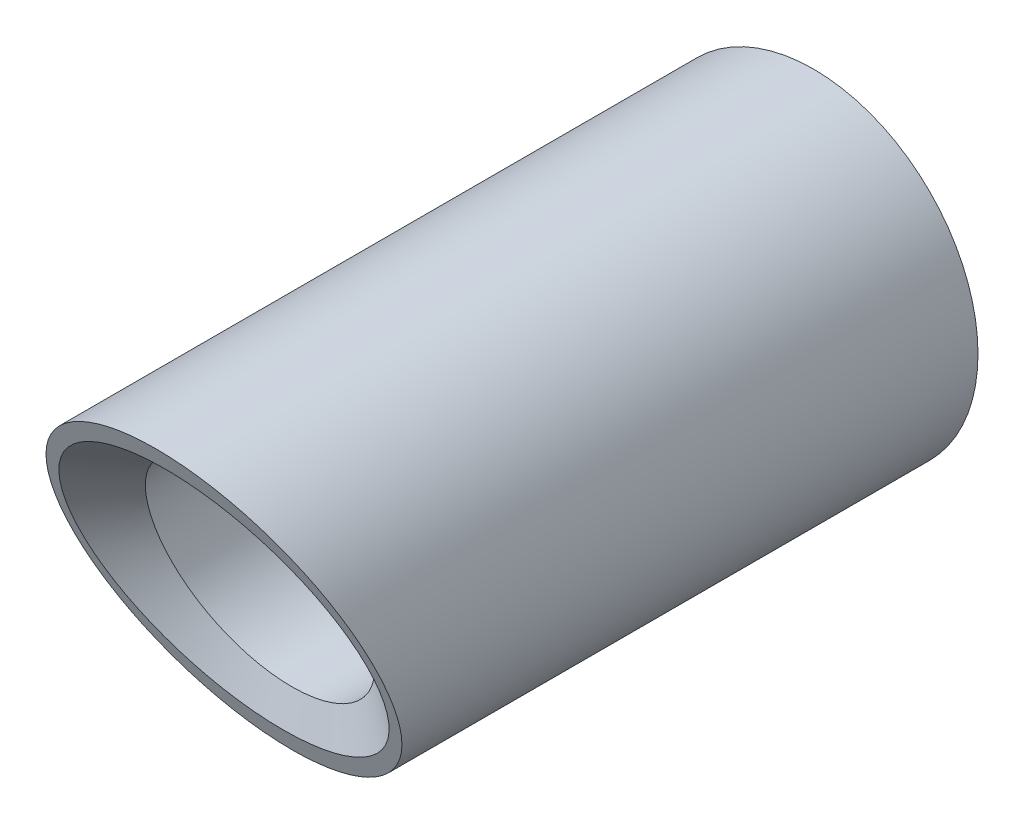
SolidWorks part; units mm, degrees
ref_plane "Vorne" through (0, 0, 0) normal (0, 0, 1) x (1, 0, 0)
ref_plane "Oben" through (0, 0, 0) normal (0, 1, 0) x (1, 0, 0)
ref_plane "Rechts" through (0, 0, 0) normal (1, 0, 0) x (0, 0, -1)
sketch "Skizze1" plane through (0, 0, 0) normal (0, 0, 1) x (1, 0, 0)
  circle A0 centre (0, 0) radius 5
  circle A1 centre (0, 0) radius 7.5
  dimension "D1" = 10
  dimension "D2" = 15
extrude "Linear austragen1" add sketch "Skizze1" along normal blind 30
sketch "Skizze2" plane through (0, 0, 0) normal (1, 0, 0) x (0, 0, -1)
  line L0 (-30, 7.5) -> (-23.7868, -7.5)
  line L1 (-30, -7.5) -> (0, -7.5) construction
  line L2 (-30, 7.5) -> (-30, -7.5) construction
  dimension "D1" = 22.5
extrude "Schnitt-Linear austragen1" cut sketch "Skizze2" against normal through all and the other way through all flip side to cut
sketch "Skizze3" plane through (0, 0, 0) normal (1, 0, 0) x (0, 0, -1)
  line L0 (-26.9877, 5) -> (-29.5858, 6.5)
  line L1 (-30, 7.5) -> (-23.7868, -7.5) construction
  line L2 (-26.9877, 5) -> (-32.6805, 5) construction
  line L3 (-26.8934, 0) -> (-6.2581, 8.5474) construction
  line L4 (-29.5858, 6.5) -> (-28.675, 4.3011)
  line L5 (-26.9877, 5) -> (-28.675, 4.3011)
  dimension "D1" = 30
  dimension "D2" = 6.5
  dimension "D3" = 5
revolve "Schnitt-Rotation1" cut sketch "Skizze3" angle 360 about L3
